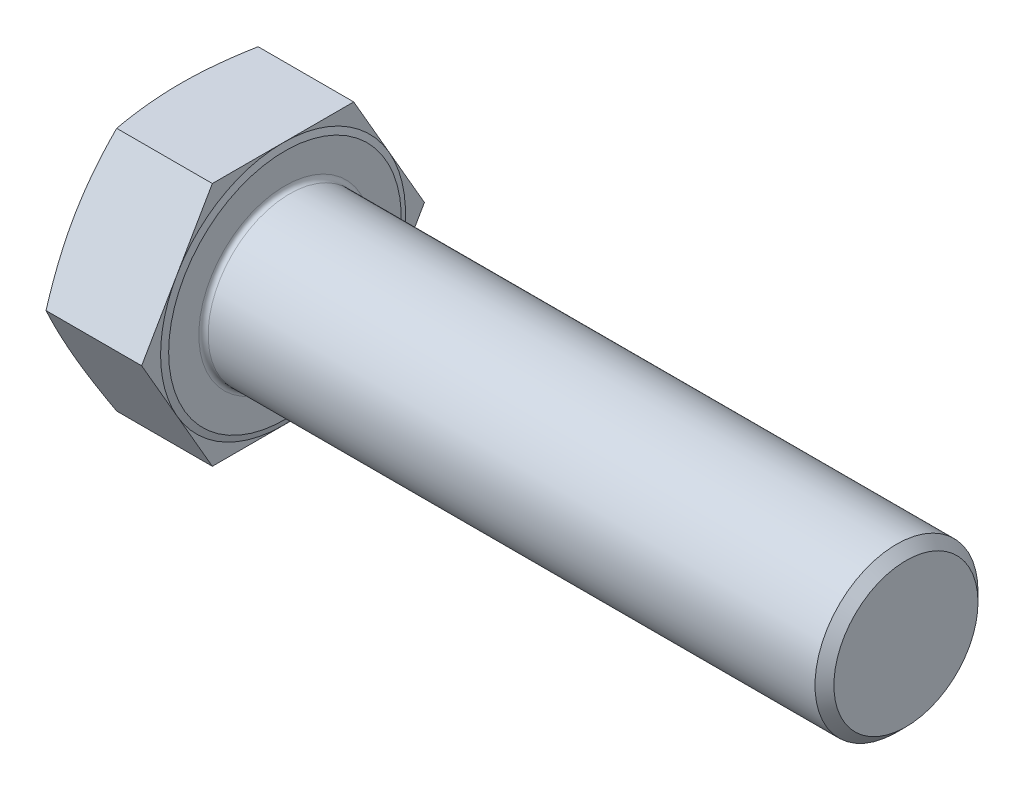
SolidWorks part; units mm, degrees
ref_plane "Front" through (0, 0, 0) normal (0, 0, 1) x (1, 0, 0)
ref_plane "Top" through (0, 0, 0) normal (0, 1, 0) x (1, 0, 0)
ref_plane "Right" through (0, 0, 0) normal (1, 0, 0) x (0, 0, -1)
sketch "Sketch-BaseHead" plane through (0, 0, 0) normal (1, 0, 0) x (0, 0, -1)
  line L1 (36.4308, 0) -> (18.2154, 31.55)
  line L2 (18.2154, 31.55) -> (-18.2154, 31.55)
  line L3 (-18.2154, 31.55) -> (-36.4308, 0)
  line L4 (-36.4308, 0) -> (-18.2154, -31.55)
  line L5 (-18.2154, -31.55) -> (18.2154, -31.55)
  line L6 (18.2154, -31.55) -> (36.4308, 0)
  circle A0 centre (0, 0) radius 31.55 construction
  dimension "s" = 63.1
extrude "BaseHead" add sketch "Sketch-BaseHead" along normal blind 26.42
sketch "Sketch4" plane through (-0.2646, 0, 5.9169) normal (0, 1, 0) x (0, 0, -1)
  line L0 (5.9169, 3.7369) -> (5.9169, -10.4477) construction
  line L2 (42.3477, -0.2646) -> (37.4669, -0.2646)
  line L4 (37.4669, -0.2646) -> (42.3477, -2.0411)
  line L6 (42.3477, -2.0411) -> (42.3477, -0.2646)
  dimension "D1" = 20
  dimension "D2" = 63.1
revolve "HeadChamfer" cut sketch "Sketch4" angle 360 about L0
sketch "Sketch1" plane through (0, 0, 0) normal (0, 0, 1) x (1, 0, 0)
  line L0 (26.42, 0) -> (26.92, 0)
  line L1 (26.92, 0) -> (26.92, -29.975)
  line L2 (26.92, -29.975) -> (26.42, -31.55)
  line L3 (26.42, -31.55) -> (26.42, 0) construction
  line L4 (0, 0) -> (7.5821, 0) construction
  line L5 (-4.0016, 0) -> (10.1831, 0) construction
  line L6 (26.42, -31.55) -> (1.7765, -31.55) construction
  line L7 (26.42, 0) -> (26.42, -31.55)
  dimension "D1" = 31.55
  dimension "c" = 0.5
  dimension "D2" = 29.975
revolve "Revolve1" add sketch "Sketch1" angle 360 about axis through (-4.0016, 0, 0) along (1, 0, 0)
ref_plane "Plane2" through (90.92, 0, 0) normal (1, 0, 0) x (0, 0, -1)
sketch "Sketch3" plane through (26.92, 0, 0) normal (1, 0, 0) x (0, 0, -1)
  circle A0 centre (0, 0) radius 21
  dimension "d" = 42
extrude "BaseBody" add sketch "Sketch3" along normal blind 160
fillet "HeadFillet" radius 1.2 1 edges at (26.92, 0, -21)
chamfer "Chamfer1" distance 2.4355 angle 45 1 edges at (186.92, 0, -21)
equation "\"D1@Sketch1\" = \"s@Sketch-BaseHead\"/ 2"
equation "\"D2@Sketch4\" = \"s@Sketch-BaseHead\""
equation "\"D1@Chamfer1\" =  ( \"d@Sketch3\" - \"D2@ThreadCosmetic1\" ) / 2 "
equation "\"b@ThreadCosmetic1\" = \"l@BaseBody\" - \"lg@Plane2\""
